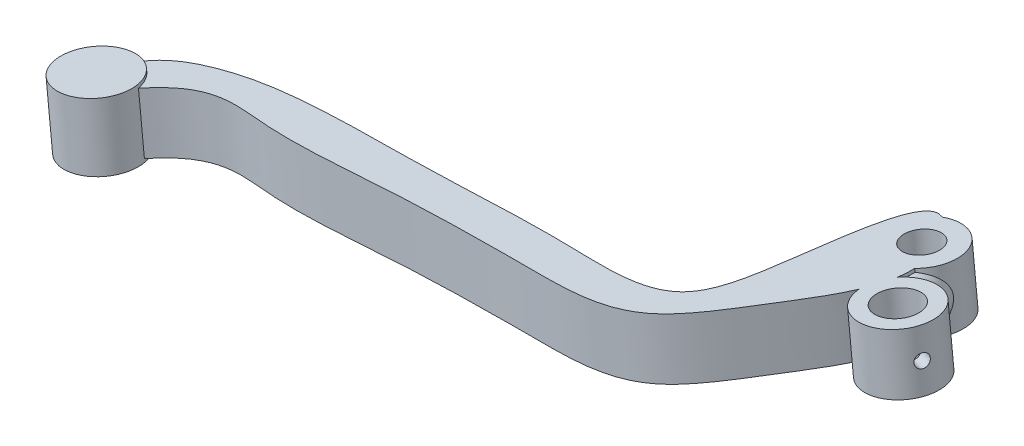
SolidWorks part; units mm, degrees
ref_plane "Alzado" through (0, 0, 0) normal (0, 0, 1) x (1, 0, 0)
ref_plane "Planta" through (0, 0, 0) normal (0, 1, 0) x (1, 0, 0)
ref_plane "Vista lateral" through (0, 0, 0) normal (1, 0, 0) x (0, 0, -1)
sketch3d "Sk_puntos_Plano_palanca"
  point P0 (247.8038, 40.2316, -26.1614)
  point P1 (297.3062, 35.1814, -31.0616)
  point P2 (252.6788, 39.7343, 23.5979)
ref_plane "Plano_palanca" through (6.6148, 64.8378, 0) normal (-0.1015, -0.9948, 0) x (-0.9948, 0.1015, 0)
sketch "Sk_Palanca" plane through (6.6148, 64.8378, 0) normal (-0.1015, -0.9948, 0) x (-0.9948, 0.1015, 0)
  spline S0 degree 3 poles (-254.9118, 3.3768) (-241.8709, -13.9666) (-252.1672, -26.5391) (-262.1509, -40.9172) (-282.5977, -38.6131) (-302.0678, -36.9124) (-321.774, -36.7308) (-335.8922, -32.7728) (-346.4274, -47.4224) (-345.1262, -34.2001) (-335.6003, -29.8606) (-321.0748, -29.329) (-301.3541, -31.6126) (-282.7257, -32.1429) (-261.0715, -35.6467) (-257.2358, -19.9312) (-254.9118, 3.3768) (-241.8709, -13.9666) (-252.1672, -26.5391) knots -0.158059 -0.111967 -0.033021 0 0.078946 0.135623 0.200779 0.301384 0.381877 0.43514 0.476712 0.500852 0.542424 0.595686 0.67618 0.776785 0.841941 0.888033 0.966979 1 1.078946 1.135623 1.200779 only from (-246.2677, -9.6359) to (-246.2677, -9.6359)
extrude "Palanca" add sketch "Sk_Palanca" along normal mid plane 9
sketch3d "Sk_Buje_pivote"
  line L0 (253.8287, 35.0936, 8.3663) -> (254.7422, 44.0471, 8.3663)
  dimension "D1" = 9
sweep "Buje_pivote" add path "Sk_Buje_pivote" parameters "D3"=11
sketch3d "Sk_Bola"
  line L0 (349.3548, 24.8454, 40.1035) -> (350.3697, 34.7938, 40.1035)
  dimension "D1" = 10
sweep "Bola" add path "Sk_Bola" parameters "D3"=11
sketch3d "Sk_Brazo_cabezal"
  line L0 (254.2854, 39.5704, 8.3663) -> (247.241, 40.289, 19.112)
  dimension "D1" = 12.869
sweep "Brazo_cabezal" add path "Sk_Brazo_cabezal" parameters "D3"=8
sketch3d "Sk_Oreja_cabezal"
  line L0 (246.7843, 35.8123, 19.112) -> (247.6978, 44.7658, 19.112)
  dimension "D1" = 9
sweep "Oreja_cabezal" add path "Sk_Oreja_cabezal" parameters "D3"=11
sketch3d "Sk_Agujero_pivote"
  line L0 (253.4735, 31.6117, 8.3663) -> (255.0974, 47.5291, 8.3663)
  dimension "D1" = 16
sweep "Agujero_pivote" cut path "Sk_Agujero_pivote" parameters "D3"=5.5
sketch3d "Sk_Alojamiento_cabezal"
  line L0 (246.6321, 34.32, 19.112) -> (247.85, 46.2581, 19.112)
  dimension "D1" = 12
sweep "Alojamiento_cabezal" cut path "Sk_Alojamiento_cabezal" parameters "D3"=6.5
sketch3d "Sk_Salida_cable"
  line L0 (247.241, 40.289, 19.112) -> (238.5451, 41.1762, 22.1835)
  dimension "D1" = 9.265
sweep "Salida_cable" cut path "Sk_Salida_cable" parameters "D3"=2
mirror "Simetria_lado_izq" about plane through (0, 0, 0) normal (1, 0, 0)
delete or keep bodies "Borrar_original_dcho" type delete bodies bodies 108
